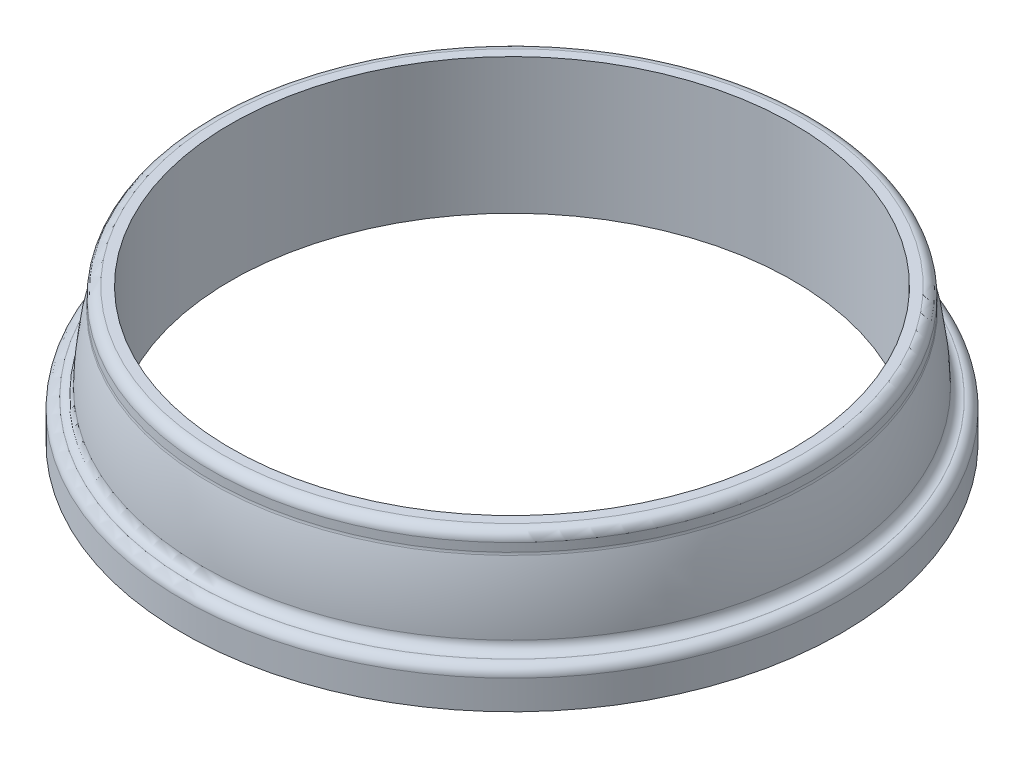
SolidWorks part; units mm, degrees
ref_plane "Alzado" through (0, 0, 0) normal (0, 0, 1) x (1, 0, 0)
ref_plane "Planta" through (0, 0, 0) normal (0, 1, 0) x (1, 0, 0)
ref_plane "Vista lateral" through (0, 0, 0) normal (1, 0, 0) x (0, 0, -1)
sketch "Croquis1" plane through (0, 0, 0) normal (0, 0, 1) x (1, 0, 0)
  line L0 (17, 0) -> (17, 2)
  line L1 (17, 2) -> (16, 2)
  line L2 (15.5, 6) -> (15.5, 7)
  line L3 (15.5, 7) -> (14.5, 7)
  line L4 (14.5, 7) -> (14.5, 0)
  line L5 (14.5, 0) -> (17, 0)
  line L6 (14.5, 0) -> (0, 0) construction
  line L7 (0, 0) -> (0, 7) construction
  line L8 (0, 7) -> (14.5, 7) construction
  arc A1 (15.5, 6) -> (16, 2) centre (1.0008, 2.1564) cw
  dimension "D8" = 15
  dimension "D1" = 14.5
  dimension "D2" = 17
  dimension "D3" = 1
  dimension "D4" = 1
  dimension "D5" = 7
  dimension "D6" = 2
  dimension "D7" = 1
revolve "Revolución1" add sketch "Croquis1" angle 360 about L7
fillet "Redondeo1" radius 0.5 4 edges at (15.5, 7, 0) (15.5, 6, 0) (17, 2, 0) (16, 2, 0)
